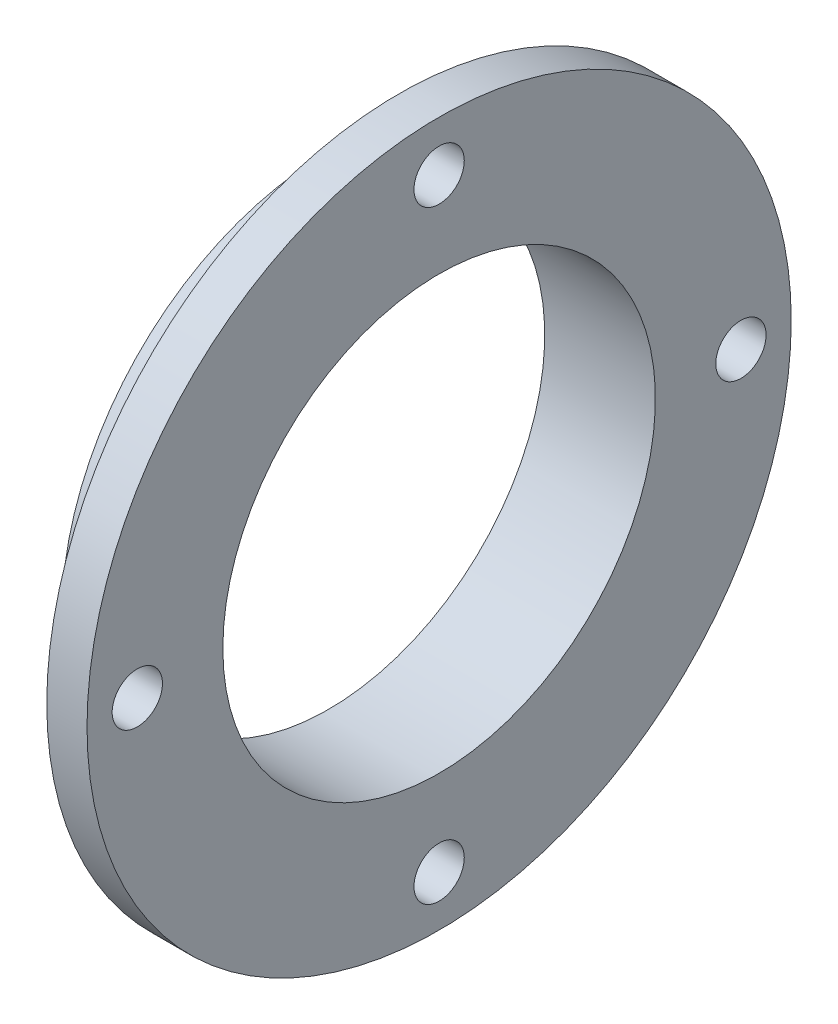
SolidWorks part; units mm, degrees
ref_plane "Front Plane" through (0, 0, 0) normal (0, 0, 1) x (1, 0, 0)
ref_plane "Top Plane" through (0, 0, 0) normal (0, 1, 0) x (1, 0, 0)
ref_plane "Right Plane" through (0, 0, 0) normal (1, 0, 0) x (0, 0, -1)
sketch "Sketch1" plane through (0, 0, 0) normal (0, 0, 1) x (1, 0, 0)
  line L0 (0, 43) -> (22, 43)
  line L1 (22, 43) -> (22, 70)
  line L2 (22, 70) -> (14, 70)
  line L3 (14, 70) -> (14, 53)
  line L4 (14, 53) -> (0, 53)
  line L5 (0, 53) -> (0, 43)
  line L6 (0, 0) -> (61.2008, 0) construction
  point P9 (11, 43)
  dimension "D1" = 43
  dimension "D2" = 53
  dimension "D3" = 22
  dimension "D4" = 8
  dimension "D5" = 70
revolve "Revolve1" add sketch "Sketch1" angle 360 about L6
hole_wizard "Ø10.0 (10) Diameter Hole1" positions "Sketch2" profile "Sketch5" hole size "Ø10.0" standard "DIN"
sketch "Sketch2" plane through (22, 0, 0) normal (1, 0, 0) x (0, 0, -1)
  line L0 (0, 60) -> (0, 0) construction
  point P0 (0, 60)
  dimension "D1" = 60
sketch "Sketch5" plane through (22, 60, 0) normal (0, 1, 0) x (0, 0, -1)
  line L0 (0, 0) -> (0, 22)
  line L1 (0, 22) -> (5, 22)
  line L2 (5, 22) -> (5, 0)
  line L5 (5, 0) -> (0, 0)
  line L11 (0, -6.35) -> (0, 107.95) construction
  dimension "Thru Hole Dia." = 10
  dimension "Thru Hole Depth" = 22
pattern_circular "CirPattern1" count 4 over 360 about axis through (0, 0, 0) along (1, 0, 0) of "Ø10.0 (10) Diameter Hole1"
